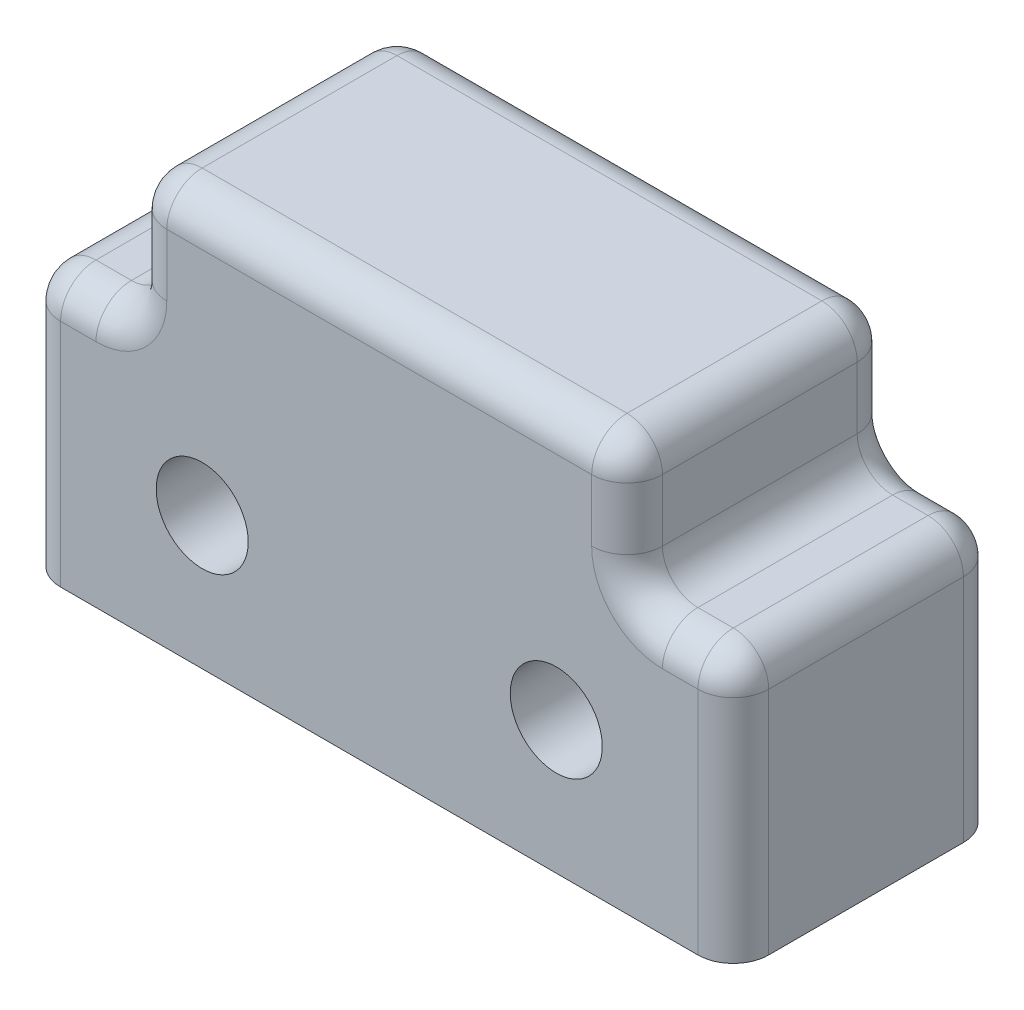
SolidWorks part; units mm, degrees
ref_plane "Front Plane" through (0, 0, 0) normal (0, 0, 1) x (1, 0, 0)
ref_plane "Top Plane" through (0, 0, 0) normal (0, 1, 0) x (1, 0, 0)
ref_plane "Right Plane" through (0, 0, 0) normal (1, 0, 0) x (0, 0, -1)
sketch "Sketch1" plane through (0, 0, 0) normal (0, 0, 1) x (1, 0, 0)
  line L1 (0, 0) -> (50.8, 0)
  line L2 (0, 0) -> (0, 19.05)
  line L3 (0, 19.05) -> (50.8, 19.05)
  line L4 (50.8, 0) -> (50.8, 19.05)
extrude "Boss-Extrude1" add sketch "Sketch1" along normal blind 19.05
sketch "Sketch3" plane through (0, 0, 19.05) normal (0, 0, 1) x (1, 0, 0)
  circle A0 centre (12.7, 9.525) radius 3.175
extrude "Cut-Extrude1" cut sketch "Sketch3" against normal through all
sketch "Sketch4" plane through (0, 0, 19.05) normal (0, 0, 1) x (1, 0, 0)
  circle A0 centre (38.1, 9.525) radius 3.1302
extrude "Cut-Extrude3" cut sketch "Sketch4" against normal through all
sketch "Sketch6" plane through (0, 19.05, 0) normal (0, 1, 0) x (1, 0, 0)
  line L0 (50.8, 0) -> (0, 0) construction
  line L1 (7.62, 0) -> (43.18, 0)
  line L2 (7.62, 0) -> (7.62, -19.05)
  line L3 (7.62, -19.05) -> (43.18, -19.05)
  line L4 (43.18, 0) -> (43.18, -19.05)
  line L5 (50.8, -19.05) -> (0, -19.05) construction
extrude "Boss-Extrude2" add sketch "Sketch6" along normal blind 9.525
sketch "Sketch7" plane through (0, 0, 0) normal (0, 0, -1) x (-1, 0, 0)
  circle A0 centre (-38.1, 9.525) radius 3.4801
  circle A1 centre (-12.7, 9.525) radius 3.4467
extrude "Cut-Extrude4" cut sketch "Sketch7" against normal through all
fillet "Fillet1" radius 2.54 6 edges at (0, 19.05, 9.525) (7.62, 19.05, 9.525) (7.62, 28.575, 9.525) (43.18, 28.575, 9.525) (50.8, 19.05, 9.525) (43.18, 19.05, 9.525)
fillet "Fillet2" radius 2.54 13 edges at (50.8, 8.255, 0) (0, 8.255, 0) (0.7439, 18.3061, 0) (3.81, 19.05, 0) (6.8761, 19.7939, 0) (7.62, 23.8125, 0) (8.3639, 27.8311, 0) (50.0561, 18.3061, 0) (46.99, 19.05, 0) (43.9239, 19.7939, 0) (43.18, 23.8125, 0) (42.4361, 27.8311, 0) (25.4, 28.575, 0)
fillet "Fillet3" radius 2.54 13 edges at (42.4361, 27.8311, 19.05) (43.18, 23.8125, 19.05) (43.9239, 19.7939, 19.05) (46.99, 19.05, 19.05) (50.0561, 18.3061, 19.05) (50.8, 8.255, 19.05) (25.4, 28.575, 19.05) (8.3639, 27.8311, 19.05) (7.62, 23.8125, 19.05) (6.8761, 19.7939, 19.05) (3.81, 19.05, 19.05) (0, 8.255, 19.05) (0.7439, 18.3061, 19.05)
sketch "Sketch8" plane through (0, 0, 19.05) normal (0, 0, 1) x (1, 0, 0)
  circle A0 centre (12.7, 9.525) radius 3.302
  circle A1 centre (12.7, 9.525) radius 3.4467
  dimension "D1" = 6.604
extrude "Boss-Extrude3" add sketch "Sketch8" against normal blind 19.05
sketch "Sketch9" plane through (0, 0, 0) normal (0, 0, -1) x (-1, 0, 0)
  circle A0 centre (-38.1, 9.525) radius 3.4801
  circle A1 centre (-38.1, 9.525) radius 3.302
  dimension "D1" = 6.604
extrude "Boss-Extrude4" add sketch "Sketch9" against normal blind 19.05
